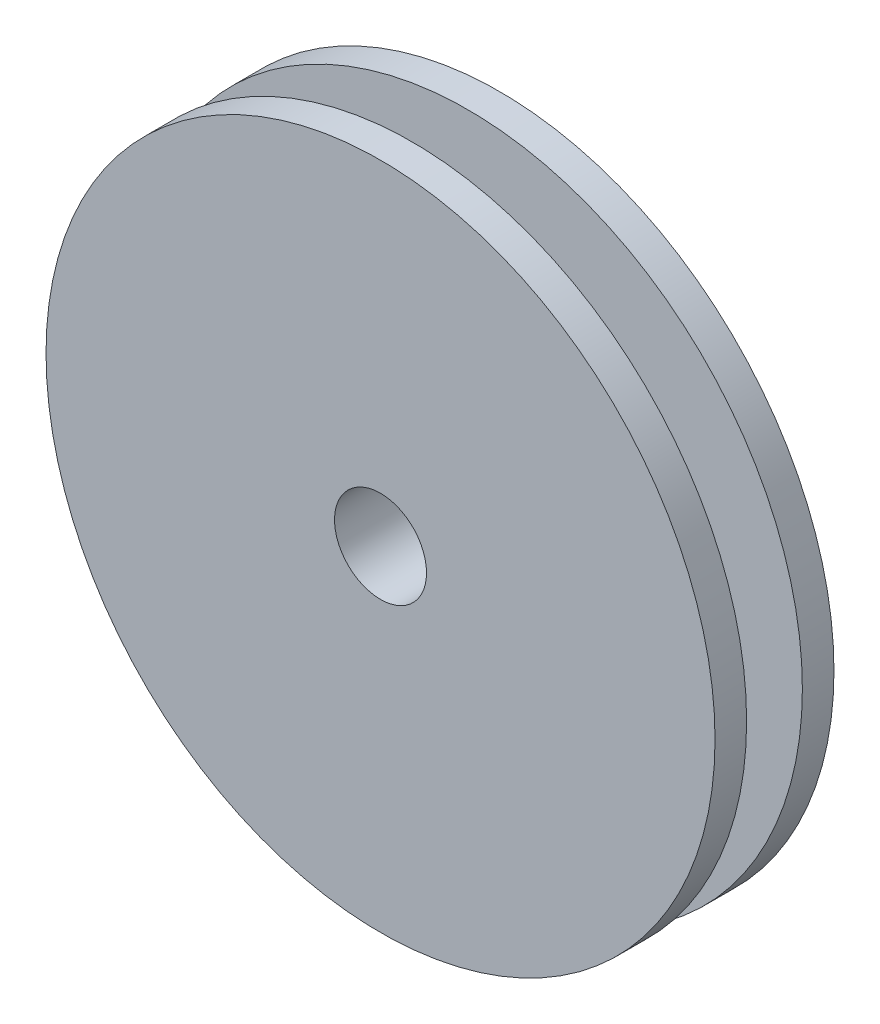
SolidWorks part; units mm, degrees
ref_plane "Front Plane" through (0, 0, 0) normal (0, 0, 1) x (1, 0, 0)
ref_plane "Top Plane" through (0, 0, 0) normal (0, 1, 0) x (1, 0, 0)
ref_plane "Right Plane" through (0, 0, 0) normal (1, 0, 0) x (0, 0, -1)
ref_plane "Plane2" through (0, 0, 30) normal (0, 0, 1) x (1, 0, 0)
sketch "Sketch1" plane through (0, 0, 30) normal (0, 0, 1) x (1, 0, 0)
  circle A0 centre (0, 0) radius 18
  dimension "D1" = 36
extrude "Boss-Extrude1" add sketch "Sketch1" along normal blind 6.4
sketch "Sketch2" plane through (0, 0, 36.4) normal (0, 0, 1) x (1, 0, 0)
  circle A0 centre (0, 0) radius 2.475
  dimension "D1" = 4.95
extrude "Cut-Extrude1" cut sketch "Sketch2" against normal blind 43 and the other way blind 17
ref_plane "Plane1" through (0, 0, 33.2) normal (0, 0, 1) x (1, 0, 0)
sketch "Sketch5" plane through (0, 0, 33.2) normal (0, 0, 1) x (1, 0, 0)
  circle A0 centre (0, 0) radius 18
  circle A1 centre (0, 0) radius 13
  dimension "D1" = 5
  dimension "D2" = 36
extrude "Cut-Extrude4" cut sketch "Sketch5" against normal mid plane 3 contours A1 | A0
